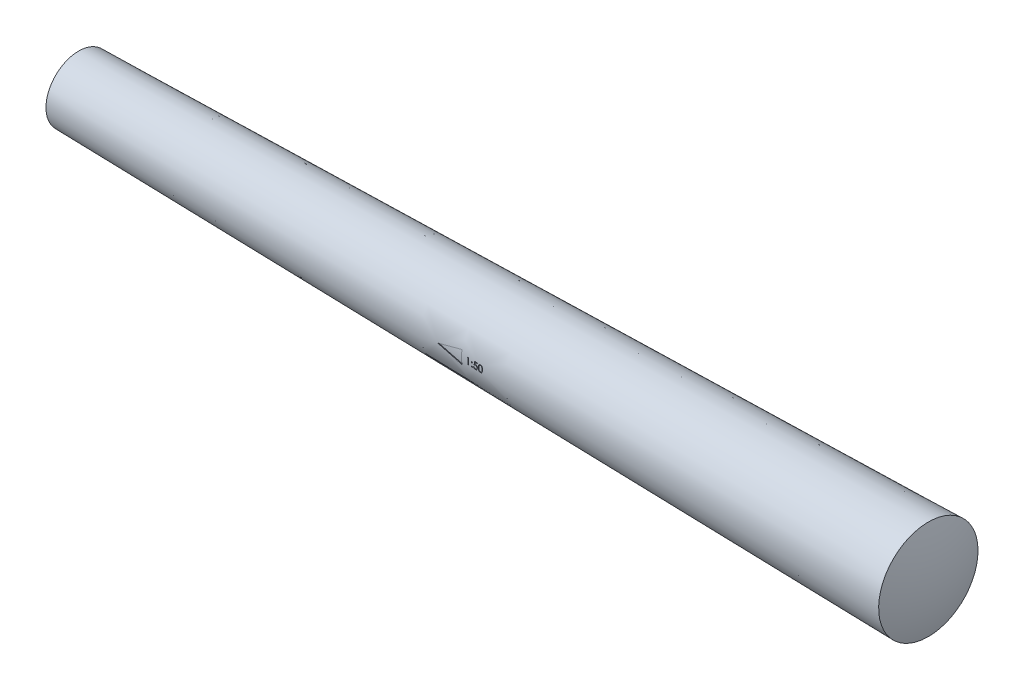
SolidWorks part; units mm, degrees
ref_plane "Front Plane" through (0, 0, 0) normal (0, 0, 1) x (1, 0, 0)
ref_plane "Top Plane" through (0, 0, 0) normal (0, 1, 0) x (1, 0, 0)
ref_plane "Right Plane" through (0, 0, 0) normal (1, 0, 0) x (0, 0, -1)
sketch "Sketch1" plane through (0, 0, 0) normal (1, 0, 0) x (0, 0, -1)
  circle A0 centre (0, 0) radius 5
  dimension "D1" = 10
extrude "Extrude1" add sketch "Sketch1" along normal mid plane 130
draft "Draft1" type of draft neutral plane draft angle 1.146 faces to draft 1 parameters "D1"=1.146
sketch "Sketch2" plane through (0, 0, 0) normal (0, 0, 1) x (1, 0, 0)
  line L0 (-65, 0) -> (-65, 5)
  line L1 (-65, 5) -> (-65, -5) construction
  line L2 (-65, 0) -> (-66.2, 0)
  line L3 (-66.2, 0) -> (-66.2, -6.3) construction
  line L4 (65, 0) -> (65, 7.6001)
  line L5 (65, -7.6001) -> (65, 7.6001) construction
  line L6 (65, 0) -> (66.2, 0)
  line L7 (66.2, 0) -> (66.2, -6.3) construction
  line L8 (-65, -5) -> (65, -7.6001) construction
  arc A0 (-66.2, 0) -> (-65, 5) centre (-55.1833, 0) cw
  arc A1 (66.2, 0) -> (65, 7.6001) centre (41.5328, 0) ccw
  point P14 (0, -6.3)
revolve "Revolve1" add sketch "Sketch2" angle 360 about L2
sketch "Sketch5" plane through (0, 0, 0) normal (0, 0, 1) x (1, 0, 0)
  line L0 (0, 6.3) -> (0, -6.3) construction
  line L1 (65, 7.6001) -> (-65, 5) construction
  line L2 (-65, -5) -> (65, -7.6001) construction
ref_plane "Plane2" through (0, 0, 0) normal (-0.02, 0, 0.9998) x (0.9998, 0, 0.02)
sketch "Sketch6" plane through (0, 0, 0) normal (-0.02, 0, 0.9998) x (0.9998, 0, 0.02)
  line L0 (0, 0) -> (0, 1)
  line L1 (0, 6.3) -> (0, -6.3) construction
  line L2 (0, 1) -> (-3.7321, 0)
  line L3 (-3.7321, 0) -> (0, -1)
  line L4 (0, -1) -> (0, 0)
  line L5 (0, -0.5) -> (4, -0.5) construction
  text T0 "1:50" font "Century Gothic" height 1
  dimension "D1" = 2
  dimension "D2" = 30
  dimension "D3" = 4
wrap "Wrap2" sketch "Sketch6" wrap type deboss source sketch "Sketch6" thickness 0.1 parameters "D1"=0.1
equation "\"D2@Sketch2\" = \"D1@Sketch2\""
